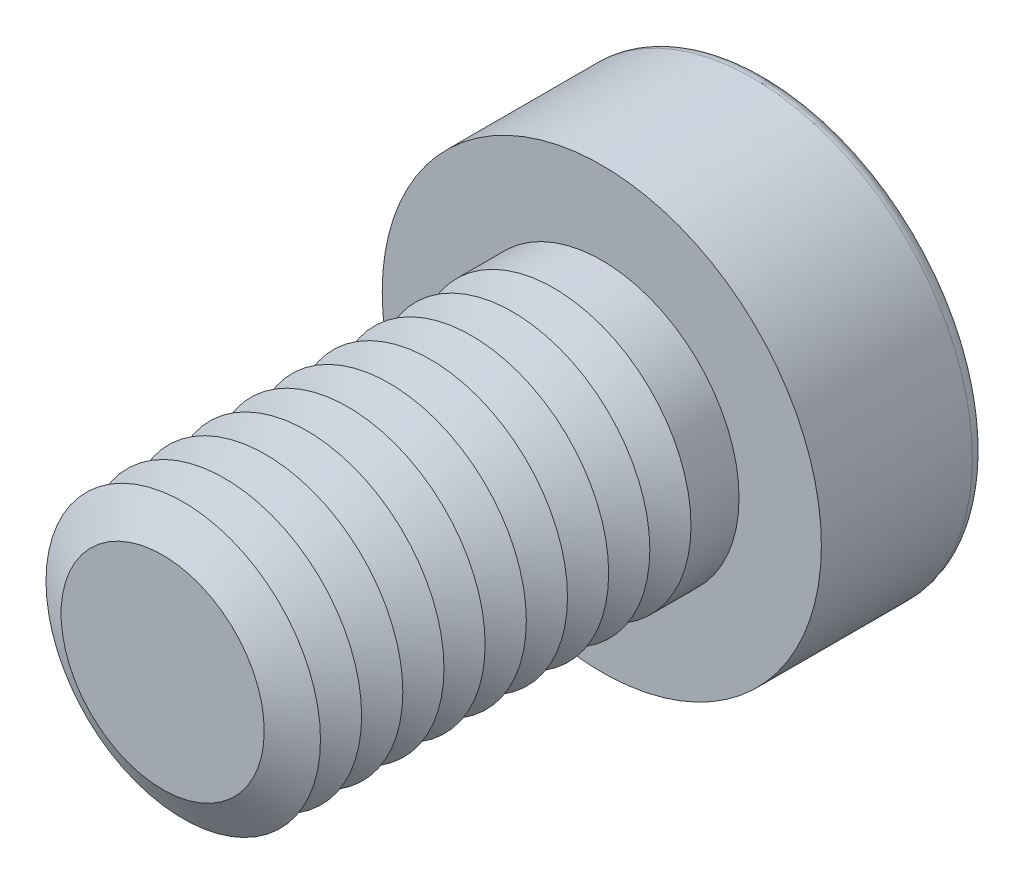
SolidWorks part; units mm, degrees
ref_plane "Front Plane" through (0, 0, 0) normal (0, 0, 1) x (1, 0, 0)
ref_plane "Top Plane" through (0, 0, 0) normal (0, 1, 0) x (1, 0, 0)
ref_plane "Right Plane" through (0, 0, 0) normal (1, 0, 0) x (0, 0, -1)
sketch "Sketch1" plane through (0, 0, 0) normal (0, 0, 1) x (1, 0, 0)
  circle A0 centre (0, 0) radius 5
  dimension "D1" = 10
extrude "Boss-Extrude1" add sketch "Sketch1" along normal blind 16
sketch "Sketch2" plane through (0, 0, 0) normal (0, 0, -1) x (-1, 0, 0)
  circle A0 centre (0, 0) radius 8
  dimension "D1" = 16
extrude "Boss-Extrude2" add sketch "Sketch2" along normal blind 6
sketch "Sketch3" plane through (0, 0, -6) normal (0, 0, -1) x (-1, 0, 0)
  line L1 (-2.0207, 3.5) -> (-4.0415, 0)
  line L2 (-4.0415, 0) -> (-2.0207, -3.5)
  line L3 (-2.0207, -3.5) -> (2.0207, -3.5)
  line L4 (2.0207, -3.5) -> (4.0415, 0)
  line L5 (4.0415, 0) -> (2.0207, 3.5)
  line L6 (2.0207, 3.5) -> (-2.0207, 3.5)
  circle A0 centre (0, 0) radius 3.5 construction
  dimension "D1" = 7
extrude "Cut-Extrude1" cut sketch "Sketch3" against normal blind 5.25
fillet "Fillet1" radius 0.5 1 edges at (-8, 0, -6)
sketch "Sketch4" plane through (0, 0, -0.75) normal (0, 0, -1) x (-1, 0, 0)
  line L0 (2.0207, -3.5) -> (4.0415, 0) construction
  circle A0 centre (0, 0) radius 3.5
extrude "Cut-Extrude2" cut sketch "Sketch4" against normal through all draft 60
sketch "Sketch5" plane through (0, 0, -6) normal (0, 0, -1) x (-1, 0, 0)
  circle A0 centre (0, 0) radius 4.0415
extrude "Cut-Extrude3" cut sketch "Sketch5" against normal through all draft 75
sketch "Sketch7" plane through (0, 0, 0) normal (1, 0, 0) x (0, 0, -1)
  line L25 (-16, 3.701) -> (-15.25, 5)
  line L26 (-16, 5) -> (-16, -5) construction
  line L27 (-15.25, 5) -> (-16.75, 5)
  line L28 (-16.75, 5) -> (-16, 3.701)
  line L29 (0, 5) -> (-16, 5) construction
  dimension "D1" = 1.5
revolve "Cut-Revolve1" cut sketch "Sketch7" angle 360 about axis through (0, 0, 16) along (0, 0, -1)
pattern_linear "LPattern1" count 10 spacing 1.5 along (0, 0, -1) of "Cut-Revolve1"
